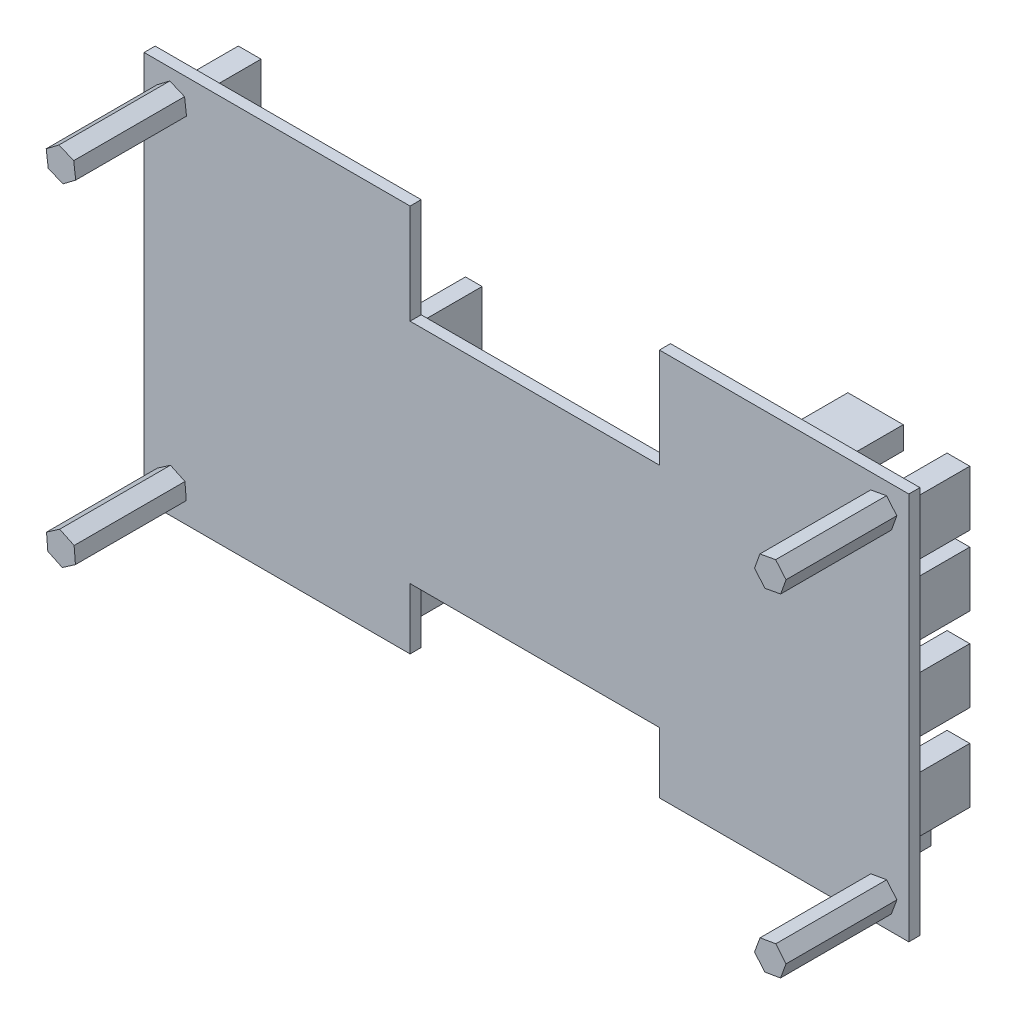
SolidWorks part; units mm, degrees
ref_plane "Plan de face" through (0, 0, 0) normal (0, 0, 1) x (1, 0, 0)
ref_plane "Plan de dessus" through (0, 0, 0) normal (0, 1, 0) x (1, 0, 0)
ref_plane "Plan de droite" through (0, 0, 0) normal (1, 0, 0) x (0, 0, -1)
sketch "Esquisse1" plane through (0, 0, 0) normal (0, 0, 1) x (1, 0, 0)
  line L1 (0, 0) -> (138, 0)
  line L2 (0, 0) -> (0, -70)
  line L3 (0, -70) -> (138, -70)
  line L4 (138, 0) -> (138, -70)
  dimension "D1" = 138
  dimension "D2" = 70
extrude "Boss.-Extru.1" add sketch "Esquisse1" along normal blind 2
sketch "Esquisse2" plane through (0, 0, 0) normal (0, 0, -1) x (-1, 0, 0)
  line L0 (-138, 0) -> (0, 0) construction
  line L1 (-48, 0) -> (-93, 0)
  line L2 (-48, 0) -> (-48, -18)
  line L3 (-48, -18) -> (-93, -18)
  line L4 (-93, 0) -> (-93, -18)
  line L5 (0, -70) -> (-138, -70) construction
  line L6 (-48, -70) -> (-93, -70)
  line L7 (-48, -70) -> (-48, -59)
  line L8 (-48, -59) -> (-93, -59)
  line L9 (-93, -70) -> (-93, -59)
  line L10 (0, 0) -> (0, -70) construction
  dimension "D1" = 11
  dimension "D2" = 18
  dimension "D3" = 45
  dimension "D4" = 45
  dimension "D5" = 48
  dimension "D6" = 48
extrude "Enlèv. mat.-Extru.1" cut sketch "Esquisse2" against normal through all
sketch "Esquisse3" plane through (0, 0, 0) normal (0, 0, -1) x (-1, 0, 0)
  line L0 (0, 0) -> (0, -70) construction
  line L1 (-22, -32) -> (-10, -32)
  line L2 (-22, -32) -> (-22, -60)
  line L3 (-22, -60) -> (-10, -60)
  line L4 (-10, -32) -> (-10, -60)
  line L5 (0, -70) -> (-48, -70) construction
  dimension "D1" = 12
  dimension "D2" = 28
  dimension "D3" = 10
  dimension "D4" = 10
extrude "Boss.-Extru.2" add sketch "Esquisse3" along normal blind 15
sketch "Esquisse4" plane through (0, 0, 0) normal (0, 0, -1) x (-1, 0, 0)
  line L0 (-138, -70) -> (-138, 0) construction
  line L1 (-135, -4.1541) -> (-130.8981, -4.1541)
  line L2 (-135, -4.1541) -> (-135, -14.1541)
  line L3 (-135, -14.1541) -> (-130.8981, -14.1541)
  line L4 (-130.8981, -4.1541) -> (-130.8981, -14.1541)
  line L5 (-130.8981, -26.7963) -> (-135, -26.7963)
  line L6 (-130.8981, -26.7963) -> (-130.8981, -16.7963)
  line L7 (-130.8981, -16.7963) -> (-135, -16.7963)
  line L8 (-135, -26.7963) -> (-135, -16.7963)
  line L9 (-135, -31.8911) -> (-130.8981, -31.8911)
  line L10 (-135, -31.8911) -> (-135, -41.8911)
  line L11 (-135, -41.8911) -> (-130.8981, -41.8911)
  line L12 (-130.8981, -31.8911) -> (-130.8981, -41.8911)
  line L13 (-135, -47.4782) -> (-130.8981, -47.4782)
  line L14 (-135, -47.4782) -> (-135, -57.4782)
  line L15 (-135, -57.4782) -> (-130.8981, -57.4782)
  line L16 (-130.8981, -47.4782) -> (-130.8981, -57.4782)
  line L17 (-3, -4.4907) -> (-7.1019, -4.4907)
  line L18 (-3, -4.4907) -> (-3, -14.4907)
  line L19 (-3, -14.4907) -> (-7.1019, -14.4907)
  line L20 (-7.1019, -4.4907) -> (-7.1019, -14.4907)
  line L21 (-7.1019, -17.2885) -> (-3, -17.2885)
  line L22 (-7.1019, -17.2885) -> (-7.1019, -27.2885)
  line L23 (-7.1019, -27.2885) -> (-3, -27.2885)
  line L24 (-3, -17.2885) -> (-3, -27.2885)
  line L25 (-3, -57) -> (-7.1019, -57)
  line L26 (-3, -57) -> (-3, -67)
  line L27 (-3, -67) -> (-7.1019, -67)
  line L28 (-7.1019, -57) -> (-7.1019, -67)
  line L29 (-128, -62.8981) -> (-118, -62.8981)
  line L30 (-128, -62.8981) -> (-128, -67)
  line L31 (-128, -67) -> (-118, -67)
  line L32 (-118, -62.8981) -> (-118, -67)
  line L33 (-113, -62.8981) -> (-103, -62.8981)
  line L34 (-113, -62.8981) -> (-113, -67)
  line L35 (-113, -67) -> (-103, -67)
  line L36 (-103, -62.8981) -> (-103, -67)
  line L37 (-46.1019, -62.8981) -> (-36.1019, -62.8981)
  line L38 (-46.1019, -62.8981) -> (-46.1019, -67)
  line L39 (-46.1019, -67) -> (-36.1019, -67)
  line L40 (-36.1019, -62.8981) -> (-36.1019, -67)
  line L41 (-33.1019, -62.8981) -> (-23.1019, -62.8981)
  line L42 (-33.1019, -62.8981) -> (-33.1019, -67)
  line L43 (-33.1019, -67) -> (-23.1019, -67)
  line L44 (-23.1019, -62.8981) -> (-23.1019, -67)
  line L45 (-20.1019, -62.8981) -> (-10.1019, -62.8981)
  line L46 (-20.1019, -62.8981) -> (-20.1019, -67)
  line L47 (-20.1019, -67) -> (-10.1019, -67)
  line L48 (-10.1019, -62.8981) -> (-10.1019, -67)
  line L49 (-7.1019, -35) -> (-3, -35)
  line L50 (-7.1019, -35) -> (-7.1019, -45)
  line L51 (-7.1019, -45) -> (-3, -45)
  line L52 (-3, -35) -> (-3, -45)
  line L53 (0, 0) -> (0, -70) construction
  line L54 (0, -70) -> (-48, -70) construction
  line L55 (-93, 0) -> (-93, -18) construction
  line L56 (-123, -3.6685) -> (-113, -3.6685)
  line L57 (-123, -3.6685) -> (-123, -7.7704)
  line L58 (-123, -7.7704) -> (-113, -7.7704)
  line L59 (-113, -3.6685) -> (-113, -7.7704)
  line L60 (-97, -20.0741) -> (-94, -20.0741)
  line L61 (-97, -20.0741) -> (-97, -58.8544)
  line L62 (-97, -58.8544) -> (-94, -58.8544)
  line L63 (-94, -20.0741) -> (-94, -58.8544)
  line L64 (-47, -20.0741) -> (-44, -20.0741)
  line L65 (-47, -20.0741) -> (-47, -58.8544)
  line L66 (-47, -58.8544) -> (-44, -58.8544)
  line L67 (-44, -20.0741) -> (-44, -58.8544)
  line L68 (-48, -18) -> (-48, 0) construction
  dimension "D1" = 3
  dimension "D2" = 3
  dimension "D3" = 3
  dimension "D4" = 3
  dimension "D5" = 3
  dimension "D6" = 10
  dimension "D7" = 5
  dimension "D8" = 15
  dimension "D9" = 12
  dimension "D10" = 10
  dimension "D11" = 3
  dimension "D12" = 3
  dimension "D13" = 3
  dimension "D14" = 1
  dimension "D15" = 1
extrude "Boss.-Extru.3" add sketch "Esquisse4" along normal blind 12
sketch "Esquisse6" plane through (0, 0, 2) normal (0, 0, 1) x (1, 0, 0)
  line L0 (0, 0) -> (0, -70) construction
  line L1 (7.6605, -6.1202) -> (7.3004, -3.256)
  line L2 (7.3004, -3.256) -> (4.6399, -2.1358)
  line L3 (4.6399, -2.1358) -> (2.3395, -3.8798)
  line L4 (2.3395, -3.8798) -> (2.6996, -6.744)
  line L5 (2.6996, -6.744) -> (5.3601, -7.8642)
  line L6 (5.3601, -7.8642) -> (7.6605, -6.1202)
  line L7 (134.8707, -7.1986) -> (135.8394, -4.4793)
  line L8 (135.8394, -4.4793) -> (133.9687, -2.2806)
  line L9 (133.9687, -2.2806) -> (131.1293, -2.8014)
  line L10 (131.1293, -2.8014) -> (130.1606, -5.5207)
  line L11 (130.1606, -5.5207) -> (132.0313, -7.7194)
  line L12 (132.0313, -7.7194) -> (134.8707, -7.1986)
  line L13 (134.8481, -67.2177) -> (135.8446, -64.5084)
  line L14 (135.8446, -64.5084) -> (133.9965, -62.2907)
  line L15 (133.9965, -62.2907) -> (131.1519, -62.7823)
  line L16 (131.1519, -62.7823) -> (130.1554, -65.4916)
  line L17 (130.1554, -65.4916) -> (132.0035, -67.7093)
  line L18 (132.0035, -67.7093) -> (134.8481, -67.2177)
  line L19 (7.6089, -66.2358) -> (7.3746, -63.3585)
  line L20 (7.3746, -63.3585) -> (4.7658, -62.1228)
  line L21 (4.7658, -62.1228) -> (2.3911, -63.7642)
  line L22 (2.3911, -63.7642) -> (2.6254, -66.6415)
  line L23 (2.6254, -66.6415) -> (5.2342, -67.8772)
  line L24 (5.2342, -67.8772) -> (7.6089, -66.2358)
  line L25 (48, 0) -> (0, 0) construction
  line L26 (138, -70) -> (138, 0) construction
  line L27 (138, 0) -> (93, 0) construction
  line L28 (93, -70) -> (138, -70) construction
  line L29 (0, -70) -> (48, -70) construction
  circle A0 centre (5, -5) radius 2.5 construction
  circle A1 centre (133, -5) radius 2.5 construction
  circle A2 centre (133, -65) radius 2.5 construction
  circle A3 centre (5, -65) radius 2.5 construction
  dimension "D1" = 5
  dimension "D2" = 5
  dimension "D3" = 5
  dimension "D4" = 5
  dimension "D5" = 5
  dimension "D6" = 5
  dimension "D7" = 5
  dimension "D8" = 5
  dimension "D9" = 5
  dimension "D10" = 5
  dimension "D11" = 5
  dimension "D12" = 5
extrude "Boss.-Extru.4" add sketch "Esquisse6" along normal blind 20
sketch "Esquisse5" plane through (0, 0, 0) normal (0, 0, -1) x (-1, 0, 0)
